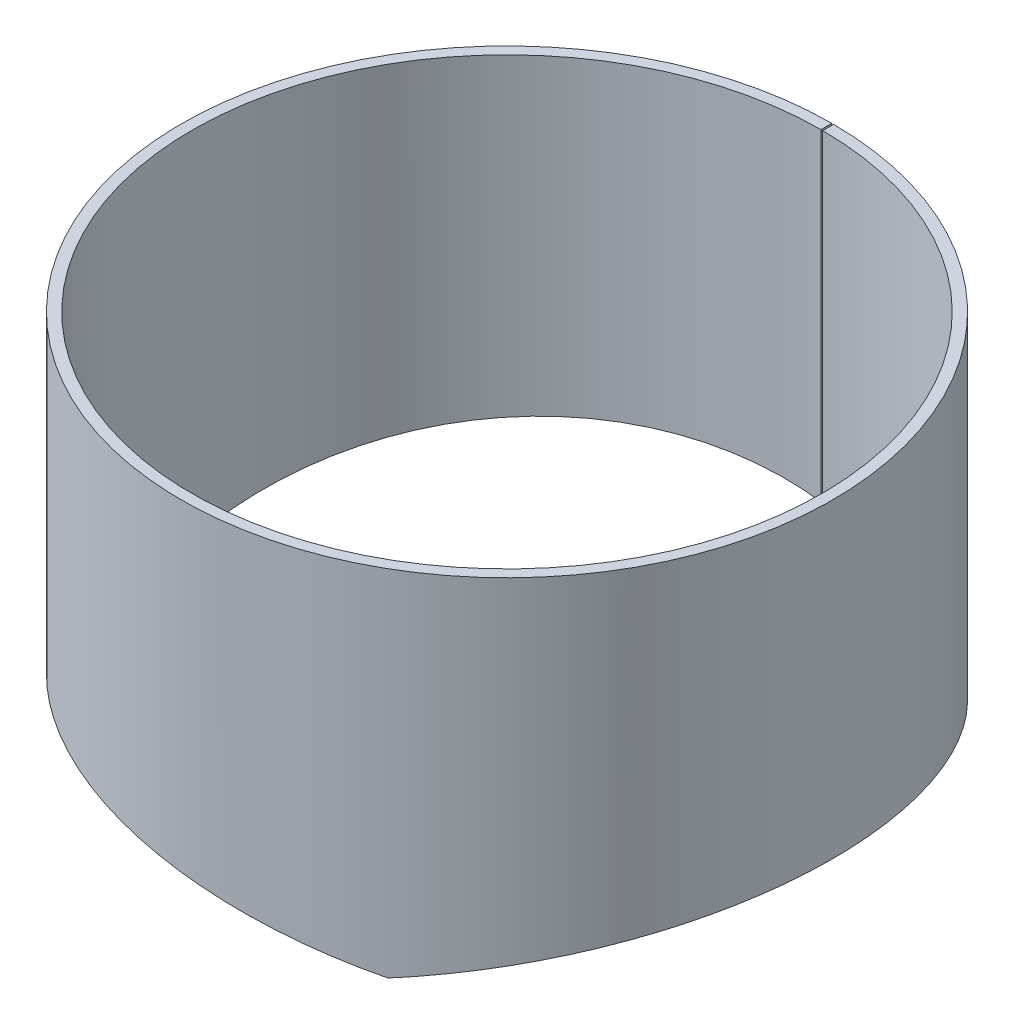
SolidWorks part; units mm, degrees
ref_plane "前视基准面" through (0, 0, 0) normal (0, 0, 1) x (1, 0, 0)
ref_plane "上视基准面" through (0, 0, 0) normal (0, 1, 0) x (1, 0, 0)
ref_plane "右视基准面" through (0, 0, 0) normal (1, 0, 0) x (0, 0, -1)
imported_body "基体零件-等径Y形四通管-1"
sheet metal parameters "钣金1" parameters "D1"=0.7366, "厚度"=6
bend "圆角折弯1" bend radius 174 bend angle 359.682 parameters "D5"=1
flatten bends "展开-折弯1" parameters "D1"=0
sketch "尖角-草图1" plane through (0.5, 130.851, -179.9993) normal (0.0028, 0, -1) x (-1, 0, -0.0028)
  line L0 (-546.1538, -89.082) -> (-546.1538, 89.149) construction
process bends "加工-折弯1" parameters "D1"=0
sketch "平面-草图1" plane through (0.5, 130.851, -179.9993) normal (0.0028, 0, -1) x (-1, 0, -0.0028)
